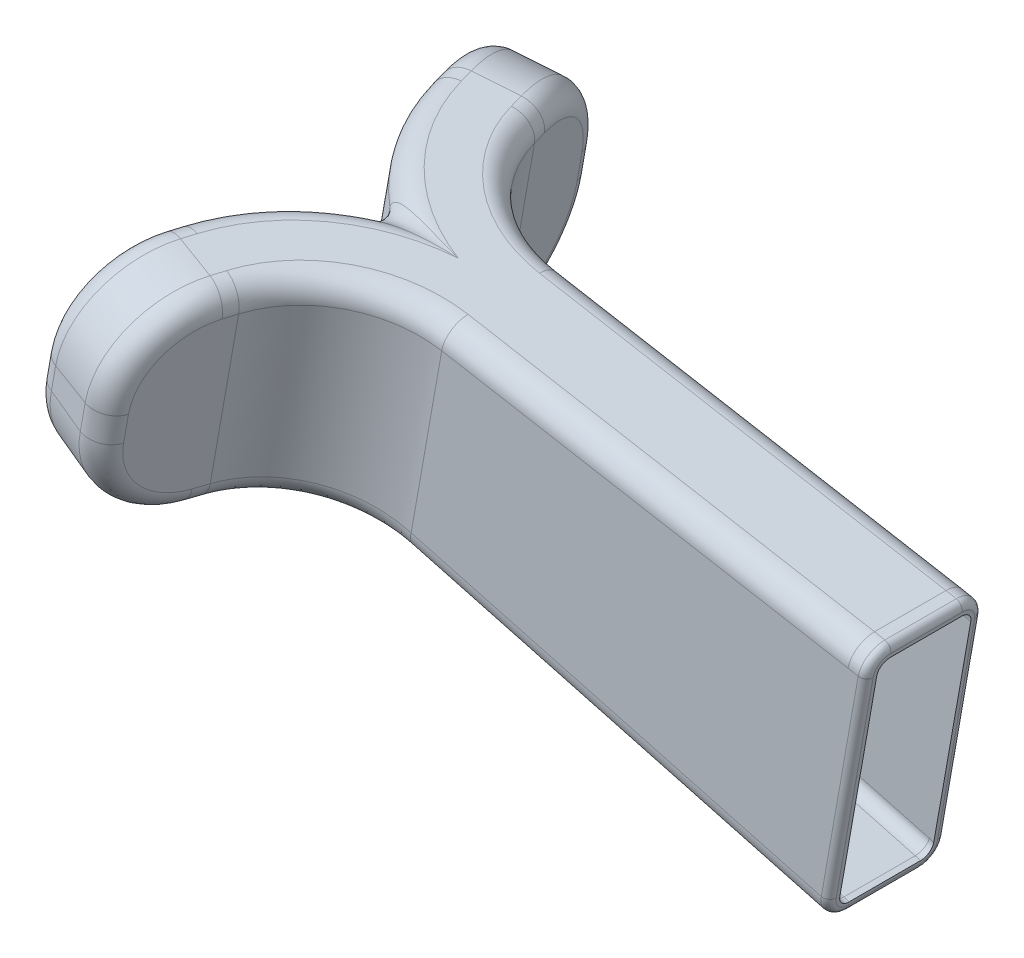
SolidWorks part; units mm, degrees
ref_plane "front" through (0, 0, 0) normal (0, 0, 1) x (1, 0, 0)
ref_plane "top" through (0, 0, 0) normal (0, 1, 0) x (1, 0, 0)
ref_plane "side" through (0, 0, 0) normal (1, 0, 0) x (0, 0, -1)
sketch "Sketch1" plane through (0, 0, 0) normal (0, 0, 1) x (1, 0, 0)
  line L0 (0, 4.7625) -> (-19.05, 4.7625)
  line L1 (0, -4.7625) -> (-25.4, -4.7625)
  line L2 (-23.5401, 6.6224) -> (-47.8835, 30.9658)
  line L3 (-59.1089, 19.7405) -> (-41.1154, 1.7471)
  line L4 (-63.3788, 22.2057) -> (-91.2266, 29.6675)
  line L5 (-61.4334, 38.0194) -> (-88.9, 42.8625)
  line L6 (-91.2266, 29.6675) -> (-88.9, 42.8625)
  arc A0 (0, 4.7625) -> (0, -4.7625) centre (0, 0) cw
  arc A1 (-25.4, -4.7625) -> (-41.1154, 1.7471) centre (-25.4, 17.4625) cw
  arc A2 (-23.5401, 6.6224) -> (-19.05, 4.7625) centre (-19.05, 11.1125) ccw
  arc A3 (-59.1089, 19.7405) -> (-63.3788, 22.2057) centre (-65.8441, 13.0053) ccw
  arc A4 (-47.8835, 30.9658) -> (-61.4334, 38.0194) centre (-65.8441, 13.0053) ccw
  dimension "D6" = 22.225
  dimension "D7" = 6.35
  dimension "D10" = 25.4
  dimension "D8" = 25.4
  dimension "D1" = 15
  dimension "D2" = 9.525
  dimension "D3" = 15.875
  dimension "D4" = 5
  dimension "D5" = 135
  dimension "D9" = 88.9
  dimension "D11" = 47.625
extrude "Base-Extrude" add sketch "Sketch1" along normal mid plane 12.7
sketch "Sketch2" plane through (0, 0, 0) normal (1, 0, 0) x (0, 0, -1)
  line L0 (0, 0) -> (0, 30.3525) construction
  line L1 (-3.175, -4.7625) -> (-3.175, 12.2372)
  line L2 (-6.35, -4.7625) -> (6.35, -4.7625) construction
  line L3 (3.175, -4.7625) -> (3.175, 12.2372)
  line L4 (-3.175, -4.7625) -> (3.175, -4.7625)
  line L5 (-6.35, 4.7625) -> (-6.35, -4.7625) construction
  arc A0 (-3.175, 12.2372) -> (-1.5875, 16.4374) centre (3.175, 12.2372) cw
  arc A1 (3.175, 12.2372) -> (1.5875, 16.4374) centre (-3.175, 12.2372) ccw
  arc A2 (-1.5875, 16.4374) -> (0, 20.6375) centre (-6.35, 20.6375) ccw
  arc A3 (1.5875, 16.4374) -> (0, 20.6375) centre (6.35, 20.6375) cw
  dimension "D1" = 6.35
  dimension "D2" = 6.35
  dimension "D3" = 3.175
  dimension "D4" = 25.4
extrude "Cut-Extrude1" cut sketch "Sketch2" against normal through all and the other way through all
sketch "Sketch3" plane through (0, 0, 0) normal (1, 0, 0) x (0, 0, -1)
  line L0 (-6.35, 6.6224) -> (-6.35, 30.9658) construction
  line L1 (-3.175, 20.6375) -> (-3.175, 42.8625)
  line L2 (-6.35, 42.8625) -> (6.35, 42.8625) construction
  line L3 (-3.175, 42.8625) -> (-6.35, 42.8625)
  line L4 (-6.35, 42.8625) -> (-6.35, 12.2372)
  line L7 (0, 20.6375) -> (0, 42.0866) construction
  arc A0 (-1.5875, 16.4374) -> (0, 20.6375) centre (-6.35, 20.6375) ccw construction
  arc A1 (-3.175, 20.6375) -> (-3.9688, 18.5374) centre (-6.35, 20.6375) cw
  arc A2 (-3.9688, 18.5374) -> (-6.35, 12.2372) centre (3.175, 12.2372) ccw
  arc A3 (-1.5875, 16.4374) -> (-3.175, 12.2372) centre (3.175, 12.2372) ccw construction
extrude "Cut-Extrude2" cut sketch "Sketch3" against normal through all
mirror "Mirror1" about plane through (0, 0, 0) normal (0, 0, 1) of "Cut-Extrude2"
sketch "Sketch4" plane through (0, 0, 6.35) normal (0, 0, 1) x (1, 0, 0)
  line L0 (0, 0) -> (-25.4, 0) construction
  circle A0 centre (0, 0) radius 2.3813
  circle A1 centre (-25.4, 0) radius 2.3813
  dimension "D1" = 4.7625
  dimension "D2" = 25.4
extrude "Cut-Extrude3" cut sketch "Sketch4" against normal through all
sketch "Sketch6" plane through (4.6493, 26.3672, 0) normal (0.1736, 0.9848, 0) x (-0.9848, 0.1736, 0)
  line L0 (94.9924, -3.175) -> (94.9924, 1.1622)
  line L1 (94.9924, 1.1622) -> (116.7049, 1.1622) construction
  line L2 (94.9924, -3.175) -> (84.325, -3.175) construction
  line L3 (94.9924, -3.175) -> (67.1021, -3.175) construction
  line L4 (103.5124, -9.8082) -> (105.0472, -15.8756)
  line L5 (105.0472, -15.8756) -> (109.252, -14.812)
  line L6 (109.252, -14.812) -> (107.7172, -8.7446)
  line L7 (103.5124, -9.8082) -> (110.9122, -7.9364) construction
  arc A0 (94.9924, -3.175) -> (103.5124, -9.8082) centre (94.9924, -11.9634) cw
  arc A1 (107.7172, -8.7446) -> (94.9924, 1.1622) centre (94.9924, -11.9634) ccw
extrude "Boss-Extrude1" add sketch "Sketch6" along normal up to surface (13.3985 mm away)
mirror "Mirror2" about plane through (0, 0, 0) normal (0, 0, 1) of "Boss-Extrude1"
fillet "Fillet1" radius 5.334 4 edges at (-100.8725, 44.9736, -15.3438) (-103.0144, 32.8261, -15.3438) (-103.0144, 32.8261, 15.3438) (-100.8725, 44.9736, 15.3438)
fillet "Fillet2" radius 0.762 48 edges at (-33.9051, -3.0707, 6.35) (-21.48, 5.2459, -6.35) (-26.3476, 9.4298, -6.35) (-46.3605, 6.9921, -6.35) (-58.471, 19.1026, -3.5707) (-77.3027, 25.9366, -3.175) (-61.6875, 21.5755, -3.175) (-36.4327, 19.515, -3.3801) (-32.5226, 15.6048, -5.7348) (-54.9732, 15.6048, -5.7348) (-54.1156, 35.5354, -3.175) (-42.7194, 25.8016, -3.175) (-75.1667, 40.4409, -3.175) (-33.9051, -3.0707, -6.35) (-12.7, -4.7625, -6.35) (4.7625, 0, -6.35) (-94.2168, 43.8, -5.0288) (-97.4022, 44.3617, -10.2563) (-99.6112, 31.9142, -10.3116) (-96.4614, 31.0702, -5.0288) (-96.4614, 31.0702, 5.0288) (-99.6112, 31.9142, 10.3116) (-97.4022, 44.3617, 10.2563) (-94.2168, 43.8, 5.0288) (-99.8971, 38.3978, 15.8756) (-98.696, 43.0034, 14.361) (-100.3486, 33.6877, 14.3999) (-99.8971, 38.3978, -15.8756) (-100.3486, 33.6877, -14.3999) (-98.696, 43.0034, -14.361) (-26.3476, 9.4298, 6.35) (-21.48, 5.2459, 6.35) (-9.525, 4.7625, 6.35) (4.7625, 0, 6.35) (-12.7, -4.7625, 6.35) (-46.3605, 6.9921, 6.35) (-77.3027, 25.9366, 3.175) (-58.471, 19.1026, 3.5707) (-54.1156, 35.5354, 3.175) (-42.7194, 25.8016, 3.175) (-75.1667, 40.4409, 3.175) (-61.6875, 21.5755, 3.175) (-32.5226, 15.6048, 5.7348) (-36.4327, 19.515, 3.3801) (-54.9732, 15.6048, 5.7348) (-9.525, 4.7625, -6.35)
fillet "Fillet3" radius 0.762 14 edges at (-100.9829, 32.2817, 3.535) (-98.8091, 44.6097, 3.535) (-103.6883, 33.0066, 9.248) (-103.6883, 33.0066, -9.248) (-104.0061, 39.3091, 14.812) (-101.5431, 45.0918, 9.1927) (-102.8369, 43.7336, 13.2974) (-104.4257, 34.7801, 13.3363) (-101.5431, 45.0918, -9.1927) (-104.0061, 39.3091, -14.812) (-104.4257, 34.7801, -13.3363) (-102.8369, 43.7336, -13.2974)
sketch "Sketch7" plane through (0, 0, 3.175) normal (0, 0, 1) x (1, 0, 0)
  line L1 (-88.9, 42.8625) -> (-61.4334, 38.0194) construction
  line L2 (-60.2459, 37.81) -> (-69.7268, -15.9588)
  line L3 (-69.7268, -15.9588) -> (9.171, -15.9588)
  line L4 (9.171, -15.9588) -> (9.171, 37.81)
  line L5 (9.171, 37.81) -> (-60.2459, 37.81)
extrude "Cut-Extrude4" cut sketch "Sketch7" against normal through all
shell "Shell1" thickness 0.762
fillet "Fillet6" radius 0.508 15 edges at (-63.4605, 21.9008, 3.4906) (-63.4605, 21.9008, -3.4906) (-60.1184, 38.5331, 0) (-60.1764, 38.2044, 3.3643) (-61.633, 29.9437, 3.937) (-63.0502, 21.9064, 3.5985) (-63.1494, 21.3437, 0) (-63.0918, 21.6705, -3.3585) (-61.633, 29.9437, -3.937) (-60.2177, 37.97, -3.6024) (-63.3619, 21.4094, 2.413) (-63.576, 21.4697, 0) (-63.3619, 21.4094, -2.413) (-63.0318, 22.9004, 3.937) (-63.0318, 22.9004, -3.937)
fillet "Fillet7" radius 1.524 5 edges at (-97.834, 31.5831, 0) (-101.8894, 33.2034, 3.6372)
